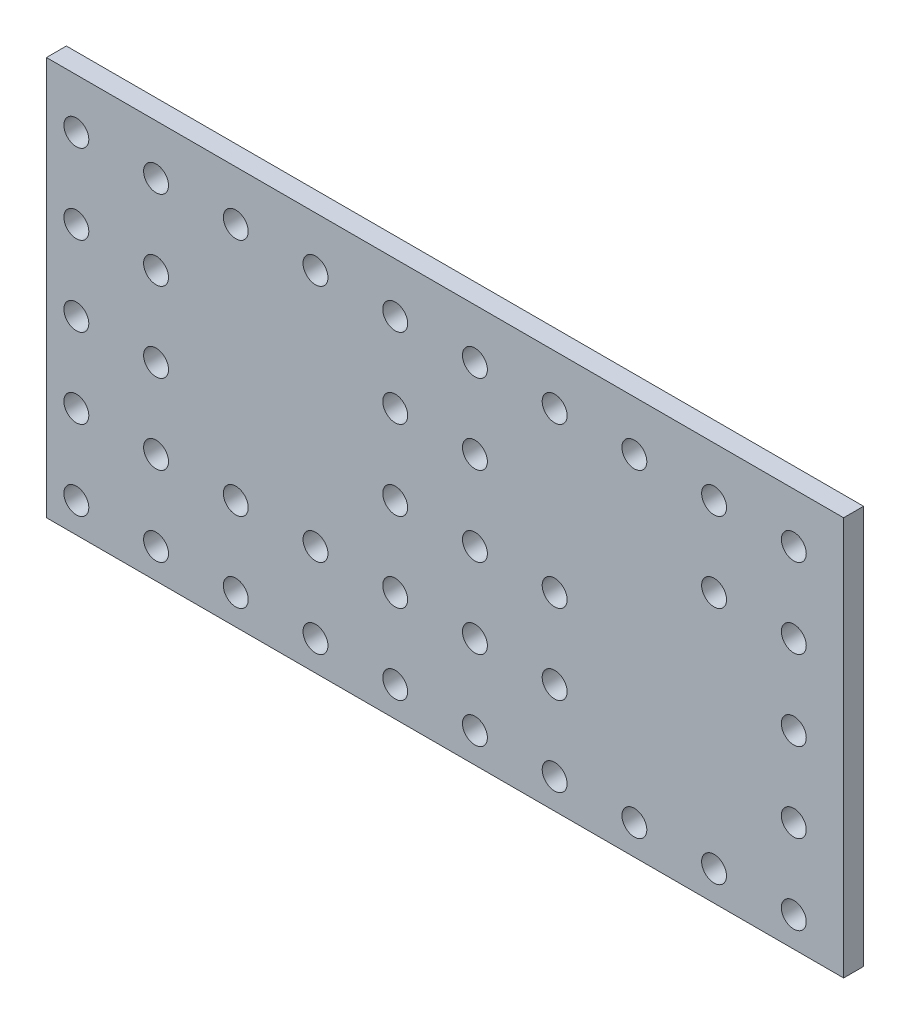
SolidWorks part; units mm, degrees
ref_plane "Front Plane" through (0, 0, 0) normal (0, 0, 1) x (1, 0, 0)
ref_plane "Top Plane" through (0, 0, 0) normal (0, 1, 0) x (1, 0, 0)
ref_plane "Right Plane" through (0, 0, 0) normal (1, 0, 0) x (0, 0, -1)
sketch "Sketch1" plane through (0, 0, 0) normal (0, 0, 1) x (1, 0, 0)
  line L1 (0, 0) -> (508, 0)
  line L2 (0, 0) -> (0, 254)
  line L3 (0, 254) -> (508, 254)
  line L4 (508, 0) -> (508, 254)
  dimension "D1" = 254
  dimension "D2" = 508
extrude "Boss-Extrude1" add sketch "Sketch1" along normal blind 12.7
sketch "Sketch2" plane through (0, 0, 12.7) normal (0, 0, 1) x (1, 0, 0)
  line L0 (0, 254) -> (0, 0) construction
  line L1 (0, 0) -> (508, 0) construction
  circle A0 centre (19.05, 19.05) radius 7.9375
  dimension "D1" = 15.875
  dimension "D2" = 19.05
  dimension "D3" = 19.05
sketch "Sketch3" plane through (0, 0, 12.7) normal (0, 0, 1) x (1, 0, 0)
  point P0 (19.05, 19.05)
  point P1 (171.45, 171.45)
  point P3 (120.65, 171.45)
  point P4 (171.45, 120.65)
  point P5 (69.85, 19.05)
  point P6 (120.65, 19.05)
  point P7 (171.45, 19.05)
  point P8 (222.25, 19.05)
  point P9 (273.05, 19.05)
  point P10 (323.85, 19.05)
  point P11 (374.65, 19.05)
  point P12 (425.45, 19.05)
  point P13 (476.25, 19.05)
  point P14 (69.85, 69.85)
  point P15 (120.65, 69.85)
  point P16 (171.45, 69.85)
  point P17 (222.25, 69.85)
  point P18 (273.05, 69.85)
  point P19 (323.85, 69.85)
  point P22 (476.25, 69.85)
  point P23 (69.85, 120.65)
  point P26 (222.25, 120.65)
  point P27 (273.05, 120.65)
  point P28 (323.85, 120.65)
  point P31 (476.25, 120.65)
  point P32 (69.85, 171.45)
  point P35 (222.25, 171.45)
  point P36 (273.05, 171.45)
  point P39 (425.45, 171.45)
  point P40 (476.25, 171.45)
  point P41 (69.85, 222.25)
  point P42 (120.65, 222.25)
  point P43 (171.45, 222.25)
  point P44 (222.25, 222.25)
  point P45 (273.05, 222.25)
  point P46 (323.85, 222.25)
  point P47 (374.65, 222.25)
  point P48 (425.45, 222.25)
  point P49 (476.25, 222.25)
  point P50 (19.05, 69.85)
  point P51 (19.05, 120.65)
  point P52 (19.05, 171.45)
  point P53 (19.05, 222.25)
  point P54 (120.65, 120.65)
  point P55 (425.45, 120.65)
  point P56 (374.65, 120.65)
  point P57 (425.45, 69.85)
  point P58 (374.65, 69.85)
  point P59 (374.65, 171.45)
  point P60 (323.85, 171.45)
  dimension "D1" = 10
  dimension "D2" = 5
extrude "Cut-Extrude2" cut sketch "Sketch2" against normal through all
pattern_sketch "Sketch-Pattern1" of "Cut-Extrude2"
